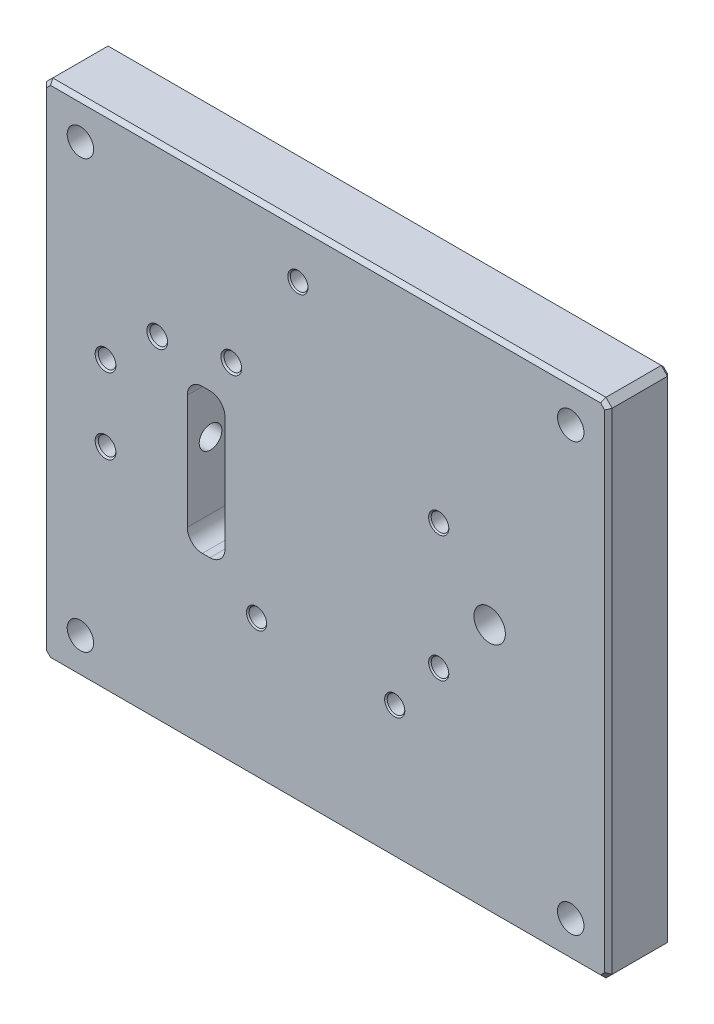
SolidWorks part; units mm, degrees
ref_plane "Plan de face" through (0, 0, 0) normal (0, 0, 1) x (1, 0, 0)
ref_plane "Plan de dessus" through (0, 0, 0) normal (0, 1, 0) x (1, 0, 0)
ref_plane "Plan de droite" through (0, 0, 0) normal (1, 0, 0) x (0, 0, -1)
sketch "Esquisse1" plane through (0, -20, 0) normal (0, 0, -1) x (1, 0, 0)
  line L0 (-280, -215) -> (-275, -220)
  line L1 (-275, -220) -> (165, -220)
  line L2 (165, -220) -> (170, -215)
  line L3 (170, -215) -> (170, 175)
  line L4 (170, 175) -> (165, 180)
  line L5 (165, 180) -> (-275, 180)
  line L6 (-275, 180) -> (-280, 175)
  line L7 (-280, 175) -> (-280, -215)
  circle A0 centre (-250, 150) radius 10.5
  circle A1 centre (140, 150) radius 10.5
  circle A2 centre (-250, -190) radius 10.5
  circle A3 centre (140, -190) radius 10.5
  dimension "D5" = 21
  dimension "D6" = 21
  dimension "D7" = 21
  dimension "D8" = 21
  dimension "D3" = 30
  dimension "D4" = 30
  dimension "D9" = 5
  dimension "D10" = 225
  dimension "D11" = 5
  dimension "D12" = 225
  dimension "D13" = 5
  dimension "D14" = 225
  dimension "D15" = 225
  dimension "D16" = 5
  dimension "D17" = 30
  dimension "D18" = 30
  dimension "D19" = 280
  dimension "D20" = 200
  dimension "D26" = 170
  dimension "D27" = 200
extrude "Volume" add sketch "Esquisse1" along normal blind 50
sketch "Positions taraudages M16 ponctuelles" plane through (0, 0, 0) normal (0, 0, 1) x (1, 0, 0)
  point P0 (35, 50)
  point P1 (35, -50)
  dimension "D1" = 50
  dimension "D2" = 50
  dimension "D3" = 35
hole_wizard "Trous taraudés M16 ponctuelles" positions "Esquisse3D3" profile "Esquisse10" tap size "M16" standard "DIN"
sketch3d "Esquisse3D3"
  point P0 (35, 50, 0)
  point P3 (35, -50, 0)
sketch "Esquisse10" plane through (35, 50, 0) normal (1, 0, 0) x (0, -1, 0)
  line L0 (0, 0) -> (0, 39.206)
  line L1 (0, 39.206) -> (7, 35)
  line L2 (7, 35) -> (7, 1.025)
  line L3 (7, 1.025) -> (8.025, 0)
  line L5 (8.025, 0) -> (0, 0)
  line L6 (-7, 1.025) -> (-8.025, 0) construction
  line L10 (0, 39.206) -> (-7, 35) construction
  line L11 (0, -6.35) -> (0, 107.95) construction
  dimension "Diamètre du trou pour taraudage" = 14
  dimension "Profondeur du trou pour taraudage" = 35
  dimension "Diamètre du fraisage entrant" = 16.05
  dimension "Angle du fraisage entrant" = 90
  dimension "Angle de pointe" = 118
sketch "Cimblot - Position chambrage M16" plane through (0, 0, 0) normal (0, 0, 1) x (1, 0, 0)
  point P0 (75.502, 0)
  dimension "D1" = 75.502
hole_wizard "Cimblot - Chambrage vis M16" positions "Esquisse24" profile "Esquisse23" counterbore size "M16" standard "ISO"
sketch "Esquisse24" plane through (0, 0, -50) normal (0, 0, -1) x (-1, 0, 0)
  point P0 (-75.502, 0)
sketch "Esquisse23" plane through (75.502, 0, -50) normal (1, 0, 0) x (0, 1, 0)
  line L0 (0, 0) -> (0, 50)
  line L1 (8.75, 49.75) -> (9, 50)
  line L2 (13, 16) -> (8.75, 16)
  line L3 (8.75, 16) -> (8.75, 49.75)
  line L5 (13, 16) -> (13, 0.75)
  line L6 (13, 0.75) -> (13.75, 0)
  line L7 (13.75, 0) -> (0, 0)
  line L8 (-13, 0.75) -> (-13.75, 0) construction
  line L11 (0, -6.35) -> (0, 107.95) construction
  line L12 (9, 50) -> (0, 50)
  line L13 (-8.75, 49.75) -> (-9, 50) construction
  dimension "Diamètre du perçage jusqu'au prochain" = 17.5
  dimension "Profondeur du perçage jusqu'au prochain" = 50
  dimension "Diamètre du chambrage" = 26
  dimension "Profondeur du chambrage" = 16
  dimension "Diamètre du fraisage entrant" = 27.5
  dimension "Angle du fraisage entrant" = 90
  dimension "Diamètre du fraisage débouchant" = 18
  dimension "Angle du fraisage débouchant" = 90
sketch "Esquisse25" plane through (0, 0, 0) normal (0, 0, 1) x (1, 0, 0)
  circle A0 centre (75.502, 0) radius 12.5
  dimension "D1" = 25
extrude "Cimblot - Lamage " cut sketch "Esquisse25" against normal blind 18
sketch "Esquisse18" plane through (0, 0, 0) normal (0, 0, 1) x (1, 0, 0)
  line L1 (-153, 50) -> (-147, 50)
  line L2 (-165, 38) -> (-165, -53)
  line L3 (-153, -65) -> (-147, -65)
  line L4 (-135, 38) -> (-135, -53)
  arc A0 (-165, -53) -> (-153, -65) centre (-153, -53) ccw
  arc A1 (-147, -65) -> (-135, -53) centre (-147, -53) ccw
  arc A2 (-147, 50) -> (-135, 38) centre (-147, 38) cw
  arc A3 (-153, 50) -> (-165, 38) centre (-153, 38) ccw
  point P11 (-135, 50)
  point P14 (-165, 50)
  dimension "D5" = 12
  dimension "D1" = 50
  dimension "D2" = 135
  dimension "D3" = 30
  dimension "D4" = 65
  dimension "D6" = 91
extrude "Logement palonnier" cut sketch "Esquisse18" against normal blind 38
sketch "Position axe palonnier" plane through (-280, 0, 0) normal (-1, 0, 0) x (0, 0, 1)
  line L2 (0, -195) -> (0, 195) construction
  point P0 (-18.5, 0)
  dimension "D1" = 18.5
hole_wizard "Axe palonnier perçage Ø17.5" positions "Esquisse3D4" profile "Esquisse14" hole size "Ø17.5" standard "ISO"
sketch3d "Esquisse3D4"
  point P0 (-280, 0, -18.5)
sketch "Esquisse14" plane through (-280, 0, -18.5) normal (0, 1, 0) x (0, 0, 1)
  line L0 (0, 0) -> (0, 175.2575)
  line L1 (0, 175.2575) -> (8.75, 170)
  line L2 (8.75, 170) -> (8.75, 0)
  line L5 (8.75, 0) -> (0, 0)
  line L10 (0, 175.2575) -> (-8.75, 170) construction
  line L11 (0, -6.35) -> (0, 107.95) construction
  dimension "Diamètre du perçage" = 17.5
  dimension "Profondeur du perçage" = 170
  dimension "Angle de pointe" = 118
sketch "Esquisse15" plane through (-280, 0, 0) normal (-1, 0, 0) x (0, 0, 1)
  circle A0 centre (-18.5, 0) radius 9
  dimension "D1" = 18
extrude "Axe plonnier alésage Ø18" cut sketch "Esquisse15" against normal blind 40 and the other way through all from surface at -145
sketch "Positions taraudages M16 pré-positionneur" plane through (0, 0, 0) normal (0, 0, 1) x (1, 0, 0)
  line L0 (-135.7761, -86.822) -> (45.7612, -95.0822) construction
  line L1 (-101.515, 0) -> (40.0524, 0) construction
  point P0 (0, -93)
  point P1 (-109.8863, -88)
  dimension "D1" = 93
  dimension "D2" = 110
  dimension "D3" = 88
hole_wizard "Taraudages M16 pré-positionneur" positions "Esquisse3D6" profile "Esquisse20" tap size "M16" standard "DIN"
sketch3d "Esquisse3D6"
  point P0 (-109.8863, -88, 0)
  point P3 (0, -93, 0)
sketch "Esquisse20" plane through (-109.8863, -88, 0) normal (1, 0, 0) x (0, -1, 0)
  line L0 (0, 0) -> (0, 46.206)
  line L1 (0, 46.206) -> (7, 42)
  line L2 (7, 42) -> (7, 1.025)
  line L3 (7, 1.025) -> (8.025, 0)
  line L5 (8.025, 0) -> (0, 0)
  line L6 (-7, 1.025) -> (-8.025, 0) construction
  line L10 (0, 46.206) -> (-7, 42) construction
  line L11 (0, -6.35) -> (0, 107.95) construction
  dimension "Diamètre du trou pour taraudage" = 14
  dimension "Profondeur du trou pour taraudage" = 42
  dimension "Diamètre du fraisage entrant" = 16.05
  dimension "Angle du fraisage entrant" = 90
  dimension "Angle de pointe" = 118
sketch "Position taraudage M16 goujon bride" plane through (0, 0, 0) normal (0, 0, 1) x (1, 0, 0)
  point P0 (-77, 160)
  dimension "D1" = 160
  dimension "D2" = 77
hole_wizard "Trou taraudé M16" positions "Esquisse3D7" profile "Esquisse22" tap size "M16" standard "DIN"
sketch3d "Esquisse3D7"
  point P0 (-77, 160, 0)
sketch "Esquisse22" plane through (-77, 160, 0) normal (1, 0, 0) x (0, -1, 0)
  line L0 (0, 0) -> (0, 46.206)
  line L1 (0, 46.206) -> (7, 42)
  line L2 (7, 42) -> (7, 1.025)
  line L3 (7, 1.025) -> (8.025, 0)
  line L5 (8.025, 0) -> (0, 0)
  line L6 (-7, 1.025) -> (-8.025, 0) construction
  line L10 (0, 46.206) -> (-7, 42) construction
  line L11 (0, -6.35) -> (0, 107.95) construction
  dimension "Diamètre du trou pour taraudage" = 14
  dimension "Profondeur du trou pour taraudage" = 42
  dimension "Diamètre du fraisage entrant" = 16.05
  dimension "Angle du fraisage entrant" = 90
  dimension "Angle de pointe" = 118
sketch "Positions taraudages M16 - Supports serrage" plane through (0, 0, 0) normal (0, 0, 1) x (1, 0, 0)
  line L0 (-198.6476, 64.6189) -> (-105.1912, 82.8358) construction
  line L1 (-188.6476, 0) -> (37.4659, 0) construction
  line L2 (-230, 50) -> (-230, -57.3238) construction
  point P6 (-130, 78)
  point P7 (-188.8916, 66.5206)
  point P9 (-230, 30)
  point P10 (-230, -30)
  dimension "D1" = 11.03
  dimension "D2" = 60
  dimension "D3" = 130
  dimension "D4" = 78
  dimension "D5" = 30
  dimension "D6" = 60
  dimension "D7" = 230
hole_wizard "Trou taraudé M16 - Supports serrage" positions "Esquisse29" profile "Esquisse28" tap size "M16" standard "DIN"
sketch "Esquisse29" plane through (0, 0, 0) normal (0, 0, 1) x (1, 0, 0)
  point P0 (-230, 30)
  point P1 (-130, 78)
  point P4 (-188.8916, 66.5206)
  point P7 (-230, -30)
sketch "Esquisse28" plane through (-230, 30, 0) normal (1, 0, 0) x (0, -1, 0)
  line L0 (0, 0) -> (0, 44.206)
  line L1 (0, 44.206) -> (7, 40)
  line L2 (7, 40) -> (7, 1.25)
  line L3 (7, 1.25) -> (8.25, 0)
  line L5 (8.25, 0) -> (0, 0)
  line L6 (-7, 1.25) -> (-8.25, 0) construction
  line L10 (0, 44.206) -> (-7, 40) construction
  line L11 (0, -6.35) -> (0, 107.95) construction
  dimension "Diamètre du trou pour taraudage" = 14
  dimension "Profondeur du trou pour taraudage" = 40
  dimension "Diamètre du fraisage entrant" = 16.5
  dimension "Angle du fraisage entrant" = 90
  dimension "Angle de pointe" = 118
chamfer "Chanfrein1" distance 3 angle 45 16 edges at (-277.5, 197.5, -50) (-280, 0, -50) (-277.5, -197.5, -50) (-55, -200, -50) (167.5, -197.5, -50) (-55, 200, -50) (170, 0, -50) (167.5, 197.5, -50) (167.5, 197.5, 0) (170, 0, 0) (167.5, -197.5, 0) (-55, -200, 0) (-277.5, -197.5, 0) (-280, 0, 0) (-277.5, 197.5, 0) (-55, 200, 0)
sketch "Axe pour assemblage" plane through (0, 0, 0) normal (0, 1, 0) x (1, 0, 0)
  line L0 (0, 19.2108) -> (0, -137.9966) construction
